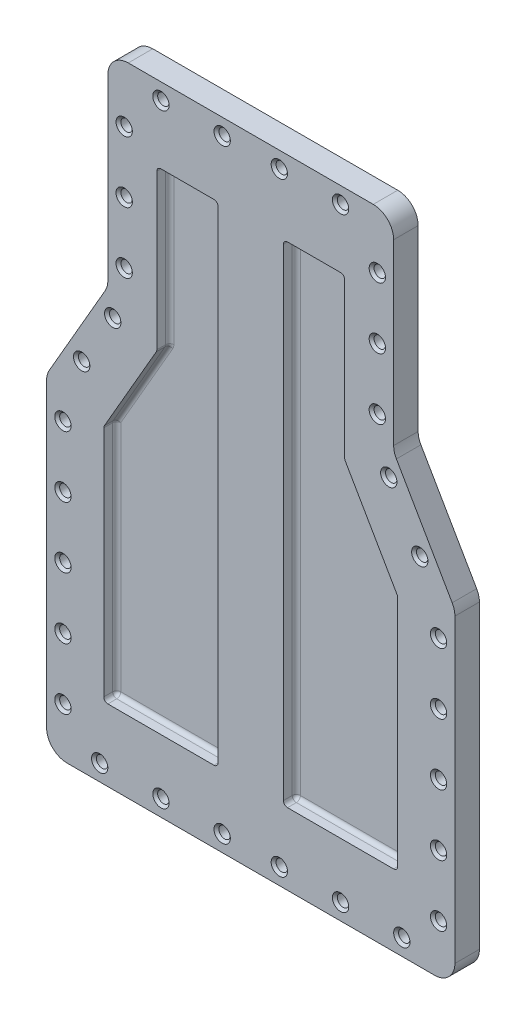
SolidWorks part; units mm, degrees
ref_plane "Front Plane" through (0, 0, 0) normal (0, 0, 1) x (1, 0, 0)
ref_plane "Top Plane" through (0, 0, 0) normal (0, 1, 0) x (1, 0, 0)
ref_plane "Right Plane" through (0, 0, 0) normal (1, 0, 0) x (0, 0, -1)
sketch "Sketch1" plane through (0, 0, 0) normal (0, 0, 1) x (1, 0, 0)
  line L0 (-175, 780) -> (-175, 530)
  line L1 (-250, 0) -> (250, 0)
  line L2 (-250, 0) -> (-250, 400)
  line L3 (-175, 780) -> (175, 780)
  line L4 (250, 0) -> (250, 400)
  line L5 (-175, 530) -> (-250, 400)
  line L7 (250, 400) -> (175, 530)
  line L8 (175, 530) -> (175, 780)
  dimension "D1" = 250
  dimension "D2" = 500
  dimension "D3" = 780
  dimension "D4" = 175
  dimension "D5" = 350
  dimension "D6" = 250
  dimension "D7" = 400
extrude "Boss-Extrude1" add sketch "Sketch1" along normal blind 30
hole_wizard "CSK for M2 Flat Head Machine Screw2" positions "Sketch5" profile "Sketch4" countersink size "M2" standard "ANSI Metric"
sketch "Sketch5" plane through (0, 0, 30) normal (0, 0, 1) x (1, 0, 0)
  line L0 (-294.6274, 20) -> (370.1384, 20) construction
  line L2 (230, -64.9529) -> (230, 537.3409) construction
  line L4 (155, 460.4524) -> (155, 825.6731) construction
  line L6 (230.7778, 760) -> (-219.3407, 760) construction
  line L7 (0, -204.3134) -> (0, 940.3652) construction
  line L9 (-155, 460.4524) -> (-155, 825.6731) construction
  point P18 (35, 20)
  point P20 (110, 20)
  point P22 (185, 20)
  point P24 (230, 60)
  point P26 (230, 135)
  point P28 (230, 210)
  point P30 (230, 285)
  point P32 (230, 360)
  point P34 (155, 560)
  point P36 (155, 635)
  point P38 (155, 710)
  point P40 (110, 760)
  point P42 (35, 760)
  point P44 (207, 435)
  point P46 (169, 500)
  point P54 (-169, 500)
  point P55 (-207, 435)
  point P56 (-35, 760)
  point P57 (-110, 760)
  point P58 (-155, 710)
  point P59 (-155, 635)
  point P60 (-155, 560)
  point P61 (-230, 360)
  point P62 (-230, 285)
  point P63 (-230, 210)
  point P64 (-230, 135)
  point P65 (-230, 60)
  point P66 (-185, 20)
  point P67 (-110, 20)
  point P68 (-35, 20)
  dimension "D1" = 20
  dimension "D2" = 230
  dimension "D3" = 155
  dimension "D4" = 740
  dimension "D5" = 35
  dimension "D6" = 110
  dimension "D7" = 185
  dimension "D8" = 40
  dimension "D9" = 115
  dimension "D10" = 190
  dimension "D11" = 265
  dimension "D12" = 340
  dimension "D13" = 415
  dimension "D14" = 480
  dimension "D15" = 690
  dimension "D16" = 615
  dimension "D17" = 540
  dimension "D18" = 207
  dimension "D19" = 169
  dimension "D20" = 35
  dimension "D21" = 110
sketch "Sketch4" plane through (35, 20, 30) normal (1, 0, 0) x (0, -1, 0)
  line L0 (0, 0) -> (0, 30)
  line L1 (0, 30) -> (7, 30)
  line L2 (7, 30) -> (7, 3)
  line L3 (7, 3) -> (10, 0)
  line L5 (10, 0) -> (0, 0)
  line L6 (-7, 3) -> (-10, 0) construction
  line L11 (0, -6.35) -> (0, 107.95) construction
  dimension "Thru Hole Dia." = 14
  dimension "Thru Hole Depth" = 30
  dimension "Near C'Sink Dia." = 20
  dimension "Near C'Sink Angle" = 90
sketch "Sketch6" plane through (0, 0, 30) normal (0, 0, 1) x (1, 0, 0)
  line L0 (180, 379.3205) -> (115, 491.9872)
  line L1 (40, 687.702) -> (115, 687.702)
  line L2 (40, 687.702) -> (40, 87.702)
  line L3 (40, 87.702) -> (180, 87.702)
  line L4 (115, 687.702) -> (115, 491.9872)
  line L6 (180, 87.702) -> (180, 379.3205)
  line L7 (250, 400) -> (175, 530) construction
  line L8 (0, -69.7691) -> (0, 810.0196) construction
  line L9 (-180, 87.702) -> (-180, 379.3205)
  line L10 (-115, 687.702) -> (-115, 491.9872)
  line L11 (-40, 87.702) -> (-180, 87.702)
  line L12 (-40, 687.702) -> (-40, 87.702)
  line L13 (-40, 687.702) -> (-115, 687.702)
  line L14 (-180, 379.3205) -> (-115, 491.9872)
  dimension "D1" = 40
  dimension "D2" = 140
  dimension "D3" = 600
  dimension "D4" = 75
  dimension "D5" = 87.702
  dimension "D6" = 70.967
extrude "Cut-Extrude1" cut sketch "Sketch6" against normal blind 15.811
sketch "Sketch7" plane through (0, 0, 0) normal (0, 0, -1) x (-1, 0, 0)
  line L44 (120, 725) -> (-120, 725)
  line L45 (120, 515.2722) -> (120, 725)
  line L46 (195, 385.2722) -> (120, 515.2722)
  line L47 (195, 55) -> (195, 385.2722)
  line L48 (-195, 55) -> (195, 55)
  line L49 (-195, 385.2722) -> (-195, 55)
  line L50 (-120, 515.2722) -> (-195, 385.2722)
  line L51 (-120, 725) -> (-120, 515.2722)
  line L52 (120, 725) -> (-120, 725)
  line L53 (120, 515.2722) -> (120, 725)
  line L54 (195, 385.2722) -> (120, 515.2722)
  line L55 (195, 55) -> (195, 385.2722)
  line L56 (-195, 55) -> (195, 55)
  line L57 (-195, 385.2722) -> (-195, 55)
  line L58 (-120, 515.2722) -> (-195, 385.2722)
  line L59 (-120, 725) -> (-120, 515.2722)
  dimension "D1" = 55
extrude "Boss-Extrude2" add sketch "Sketch7" along normal blind 40
sketch "Sketch8" plane through (0, 0, -40) normal (0, 0, -1) x (-1, 0, 0)
  line L0 (-195, 55) -> (195, 55) construction
  line L1 (-40, 655) -> (40, 655)
  line L2 (-40, 655) -> (-40, 505)
  line L3 (-40, 505) -> (40, 505)
  line L4 (40, 655) -> (40, 505)
  line L5 (-40, 455) -> (40, 455)
  line L6 (-40, 455) -> (-40, 305)
  line L7 (-40, 305) -> (40, 305)
  line L8 (40, 455) -> (40, 305)
  dimension "D1" = 150
  dimension "D2" = 150
  dimension "D3" = 50
  dimension "D4" = 250
  dimension "D5" = 40
  dimension "D6" = 80
extrude "Boss-Extrude3" add sketch "Sketch8" along normal blind 50
sketch "Sketch9" plane through (0, 305, 0) normal (0, -1, 0) x (1, 0, 0)
  line L0 (40, -90) -> (-40, -90) construction
  line L2 (-12.5, -65) -> (-12.5, -100.0631)
  line L3 (-12.5, -100.0631) -> (12.5, -100.0631)
  line L4 (12.5, -65) -> (12.5, -100.0631)
  arc A0 (-12.5, -65) -> (12.5, -65) centre (0, -65) cw
  dimension "D2" = 12.5
  dimension "D1" = 25
  dimension "D3" = 25
  dimension "D4" = 0
extrude "Cut-Extrude2" cut sketch "Sketch9" against normal through all
sketch "Sketch10" plane through (0, 0, -40) normal (0, 0, -1) x (-1, 0, 0)
  line L0 (-195, 55) -> (195, 55) construction
  line L2 (-25, 205) -> (-25, -37.0393)
  line L3 (-25, -37.0393) -> (25, -37.0393)
  line L4 (25, 205) -> (25, -37.0393)
  arc A0 (-25, 205) -> (25, 205) centre (0, 205) cw
  dimension "D3" = 150
  dimension "D1" = 50
  dimension "D2" = 25
extrude "Cut-Extrude3" cut sketch "Sketch10" against normal blind 25.125
sketch "Sketch11" plane through (0, 0, -40) normal (0, 0, -1) x (-1, 0, 0)
  line L0 (79, 338) -> (101, 403)
  line L1 (79, 273) -> (154, 273)
  line L2 (79, 273) -> (79, 338)
  line L3 (40, 305) -> (40, 455) construction
  line L4 (154, 273) -> (154, 338)
  line L5 (132, 403) -> (101, 403)
  line L6 (132, 403) -> (154, 338)
  line L7 (-195, 55) -> (195, 55) construction
  line L8 (0, -43.3508) -> (0, 492.2255) construction
  line L9 (-132, 403) -> (-154, 338)
  line L10 (-132, 403) -> (-101, 403)
  line L11 (-154, 273) -> (-154, 338)
  line L12 (-79, 273) -> (-79, 338)
  line L13 (-79, 273) -> (-154, 273)
  line L14 (-79, 338) -> (-101, 403)
  dimension "D1" = 31
  dimension "D2" = 75
  dimension "D3" = 22
  dimension "D4" = 65
  dimension "D5" = 130
  dimension "D6" = 39
  dimension "D7" = 218
extrude "Cut-Extrude4" cut sketch "Sketch11" against normal blind 26.25
sketch "Sketch12" plane through (0, 0, -40) normal (0, 0, -1) x (-1, 0, 0)
  line L0 (0, -48.461) -> (0, 270.1738) construction
  line L1 (65, 225) -> (125, 225)
  line L2 (65, 225) -> (65, 105)
  line L3 (-125, 225) -> (-125, 105)
  line L4 (125, 225) -> (125, 105)
  line L5 (-65, 225) -> (-65, 105)
  line L6 (-65, 225) -> (-125, 225)
  arc A0 (65, 105) -> (125, 105) centre (95, 105) ccw
  arc A1 (-65, 105) -> (-125, 105) centre (-95, 105) cw
  dimension "D1" = 60
  dimension "D2" = 65
  dimension "D3" = 225
  dimension "D4" = 120
extrude "Boss-Extrude4" add sketch "Sketch12" along normal blind 65
sketch "Sketch14" plane through (-125, 0, 0) normal (-1, 0, 0) x (0, 0, 1)
  line L0 (-40, 225) -> (-121.3524, 23.6457)
  line L2 (-121.3524, 225) -> (-121.3524, 23.6457)
  line L4 (-105, 225) -> (-40, 225) construction
  line L5 (-121.3524, 225) -> (-40, 225)
  dimension "D1" = 68
extrude "Cut-Extrude5" cut sketch "Sketch14" against normal through all
hole_wizard "M8x1.25 Tapped Hole1" positions "Sketch16" profile "Sketch15" tap size "M8x1.25" standard "ANSI Metric"
sketch "Sketch16" plane through (0, 0, -90) normal (0, 0, -1) x (-1, 0, 0)
  line L4 (77.4356, 625) -> (-79.1358, 625) construction
  line L6 (-79.1358, 580) -> (77.4356, 580) construction
  line L8 (77.4356, 535) -> (-79.1358, 535) construction
  line L18 (40, 655) -> (12.5, 655) construction
  point P39 (26.25, 625)
  point P41 (26.25, 580)
  point P43 (26.25, 535)
  point P57 (-26.25, 535)
  point P59 (-26.25, 580)
  point P61 (-26.25, 625)
  dimension "D3" = 30
  dimension "D4" = 45
  dimension "D5" = 45
sketch "Sketch15" plane through (-26.25, 625, -90) normal (1, 0, 0) x (0, 1, 0)
  line L0 (0, 0) -> (0, 26.9979)
  line L1 (0, 26.9979) -> (3.325, 25)
  line L2 (3.325, 25) -> (3.325, 0)
  line L5 (3.325, 0) -> (0, 0)
  line L10 (0, 26.9979) -> (-3.325, 25) construction
  line L11 (0, -6.35) -> (0, 107.95) construction
  dimension "Tap Drill Dia." = 6.65
  dimension "Tap Drill Depth" = 25
  dimension "Drill Angle" = 118
hole_wizard "Ø0.15 (0.15) Diameter Hole3" positions "Sketch18" profile "Sketch17" hole size "Ø0.15" standard "ANSI Metric"
sketch "Sketch18" plane through (0, 0, -90) normal (0, 0, -1) x (-1, 0, 0)
  line L0 (-26.25, 465.5683) -> (-26.25, 272.6912) construction
  line L2 (26.25, 272.6912) -> (26.25, 465.5683) construction
  line L4 (61.9453, 425) -> (-55.7173, 425) construction
  line L6 (-55.7173, 380) -> (61.9453, 380) construction
  line L8 (61.9453, 335) -> (-55.7173, 335) construction
  line L10 (40, 305) -> (40, 455) construction
  line L11 (40, 455) -> (12.5, 455) construction
  point P25 (26.25, 335)
  point P27 (26.25, 380)
  point P29 (26.25, 425)
  point P31 (-26.25, 425)
  point P33 (-26.25, 380)
  point P35 (-26.25, 335)
  dimension "D1" = 13.75
  dimension "D2" = 52.5
  dimension "D3" = 45
  dimension "D4" = 45
  dimension "D5" = 30
sketch "Sketch17" plane through (-26.25, 335, -90) normal (1, 0, 0) x (0, 1, 0)
  line L0 (0, 0) -> (0, 26.9979)
  line L1 (0, 26.9979) -> (3.325, 25)
  line L2 (3.325, 25) -> (3.325, 0)
  line L5 (3.325, 0) -> (0, 0)
  line L10 (0, 26.9979) -> (-3.325, 25) construction
  line L11 (0, -6.35) -> (0, 107.95) construction
  dimension "Hole Dia." = 6.65
  dimension "Hole Depth" = 25
  dimension "Drill Angle" = 118
hole_wizard "Ø0.15 (0.15) Diameter Hole1" positions "Sketch20" profile "Sketch19" hole size "Ø0.15" standard "ANSI Metric"
sketch "Sketch20" plane through (0, 0, 0) normal (0, 0, -1) x (-1, 0, 0)
  point P0 (148.588, 752.095)
  point P2 (-223.588, 25)
  dimension "D1" = 223.588
  dimension "D2" = 25
  dimension "D3" = 148.588
  dimension "D4" = 752.095
sketch "Sketch19" plane through (-148.588, 752.095, 0) normal (1, 0, 0) x (0, 1, 0)
  line L0 (0, 0) -> (0, 18.6352)
  line L1 (0, 18.6352) -> (6.05, 15)
  line L2 (6.05, 15) -> (6.05, 0)
  line L5 (6.05, 0) -> (0, 0)
  line L10 (0, 18.6352) -> (-6.05, 15) construction
  line L11 (0, -6.35) -> (0, 107.95) construction
  dimension "Hole Dia." = 12.1
  dimension "Hole Depth" = 15
  dimension "Drill Angle" = 118
hole_wizard "Ø0.15 (0.15) Diameter Hole2" positions "Sketch22" profile "Sketch21" hole size "Ø0.15" standard "ANSI Metric"
sketch "Sketch22" plane through (-40, 0, 0) normal (-1, 0, 0) x (0, 0, 1)
  line L0 (-90, 655) -> (-40, 655) construction
  line L2 (-90, 505) -> (-90, 655) construction
  line L3 (-90, 305) -> (-90, 455) construction
  point P0 (-78, 602.5)
  point P2 (-78, 402.5)
  dimension "D1" = 52.5
  dimension "D2" = 12
  dimension "D3" = 12
  dimension "D4" = 200
sketch "Sketch21" plane through (-40, 602.5, -78) normal (0, 1, 0) x (0, 0, 1)
  line L0 (0, 0) -> (0, 290)
  line L1 (0, 290) -> (5, 290)
  line L2 (5, 290) -> (5, 0)
  line L5 (5, 0) -> (0, 0)
  line L11 (0, -6.35) -> (0, 107.95) construction
  dimension "Thru Hole Dia." = 10
  dimension "Thru Hole Depth" = 290
hole_wizard "M12x1.75 Tapped Hole1" positions "Sketch24" profile "Sketch23" tap size "M12x1.75" standard "ANSI Metric"
sketch "Sketch24" plane through (0, 45.4674, -112.5359) normal (0, 0.3746, -0.9272) x (-1, 0, 0)
  line L0 (125, 64.2079) -> (125, 193.6321) construction
  point P0 (95, 64.2079)
  point P2 (95, 159.2079)
  point P4 (-95, 159.2079)
  point P6 (-95, 64.2079)
  dimension "D1" = 30
  dimension "D2" = 30
  dimension "D3" = 0
  dimension "D4" = 95
  dimension "D5" = 95
  dimension "D6" = 0
  dimension "D7" = 190
  dimension "D8" = 190
sketch "Sketch23" plane through (-95, 105, -88.4831) normal (1, 0, 0) x (0, 0.9272, 0.3746)
  line L0 (0, 0) -> (0, 33.0644)
  line L1 (0, 33.0644) -> (5.1, 30)
  line L2 (5.1, 30) -> (5.1, 0)
  line L5 (5.1, 0) -> (0, 0)
  line L10 (0, 33.0644) -> (-5.1, 30) construction
  line L11 (0, -6.35) -> (0, 107.95) construction
  dimension "Tap Drill Dia." = 10.2
  dimension "Tap Drill Depth" = 30
  dimension "Drill Angle" = 118
hole_wizard "CBORE for M5 Hex Head Bolt1" positions "Sketch26" profile "Sketch25" counterbore size "M5" standard "ANSI Metric"
sketch "Sketch26" plane through (0, 45.4674, -112.5359) normal (0, 0.3746, -0.9272) x (-1, 0, 0)
  line L0 (125, 64.2079) -> (125, 193.6321) construction
  point P0 (95, 94.2079)
  point P2 (95, 129.2079)
  point P4 (-95, 129.2079)
  point P6 (-95, 94.2079)
  dimension "D1" = 30
  dimension "D2" = 30
  dimension "D3" = 190
  dimension "D4" = 190
  dimension "D5" = 35
  dimension "D6" = 35
  dimension "D7" = 30
  dimension "D8" = 30
sketch "Sketch25" plane through (-95, 132.8155, -77.2449) normal (1, 0, 0) x (0, 0.9272, 0.3746)
  line L0 (0, 0) -> (0, 43.6052)
  line L1 (0, 43.6052) -> (6, 40)
  line L2 (6, 40) -> (6, 20)
  line L3 (6, 20) -> (10, 20)
  line L4 (10, 20) -> (10, 0)
  line L5 (10, 0) -> (0, 0)
  line L10 (0, 43.6052) -> (-6, 40) construction
  line L11 (0, -6.35) -> (0, 107.95) construction
  dimension "Hole Dia." = 12
  dimension "Hole Depth" = 40
  dimension "C'Bore Dia." = 20
  dimension "C'Bore Depth" = 20
  dimension "Drill Angle" = 118
fillet "Fillet1" radius 25 8 edges at (-250, 0, 15) (-250, 400, 15) (-175, 530, 15) (-175, 780, 15) (250, 0, 15) (250, 400, 15) (175, 530, 15) (175, 780, 15)
fillet "Fillet2" radius 13 8 edges at (-120, 725, -20) (-120, 515.2722, -20) (-195, 385.2722, -20) (-195, 55, -20) (195, 55, -20) (195, 385.2722, -20) (120, 515.2722, -20) (120, 725, -20)
fillet "Fillet3" radius 5 33 edges at (116.1924, 721.1924, 0) (0, 725, 0) (-116.1924, 721.1924, 0) (-120, 615.3767, 0) (-120.4424, 515.3907, 0) (-157.5, 450.2722, 0) (-194.5576, 385.1538, 0) (-195, 224.8956, 0) (-191.1924, 58.8076, 0) (0, 55, 0) (191.1924, 58.8076, 0) (195, 224.8956, 0) (194.5576, 385.1538, 0) (157.5, 450.2722, 0) (120.4424, 515.3907, 0) (-103.5, 55, -40) (-191.1924, 58.8076, -40) (-195, 224.8956, -40) (-194.5576, 385.1538, -40) (-157.5, 450.2722, -40) (-120.4424, 515.3907, -40) (-120, 615.3767, -40) (-116.1924, 721.1924, -40) (0, 725, -40) (116.1924, 721.1924, -40) (120, 615.3767, -40) (120.4424, 515.3907, -40) (103.5, 55, -40) (191.1924, 58.8076, -40) (195, 224.8956, -40) (194.5576, 385.1538, -40) (120, 615.3767, 0) (157.5, 450.2722, -40)
fillet "Fillet4" radius 2.5 3 edges at (25, 130, -14.875) (0, 230, -14.875) (-25, 130, -14.875)
fillet "Fillet5" radius 4 16 edges at (40, 305, -65) (-40, 305, -65) (-40, 455, -65) (40, 455, -65) (40, 505, -65) (-40, 505, -65) (-40, 655, -65) (40, 655, -65) (40, 380, -40) (0, 305, -40) (-40, 380, -40) (0, 455, -40) (0, 505, -40) (-40, 580, -40) (0, 655, -40) (40, 580, -40)
fillet "Fillet6" radius 5 54 edges at (-180, 233.5113, 14.189) (-147.5, 435.6538, 14.189) (-115, 589.8446, 14.189) (-77.5, 687.702, 14.189) (-40, 387.702, 14.189) (-110, 87.702, 14.189) (77.5, 687.702, 14.189) (115, 589.8446, 14.189) (147.5, 435.6538, 14.189) (180, 233.5113, 14.189) (110, 87.702, 14.189) (40, 387.702, 14.189) (-40, 87.702, 22.0945) (-40, 687.702, 22.0945) (-115, 687.702, 22.0945) (-115, 491.9872, 22.0945) (-180, 379.3205, 22.0945) (-180, 87.702, 22.0945) (40, 87.702, 22.0945) (40, 687.702, 22.0945) (115, 687.702, 22.0945) (115, 491.9872, 22.0945) (180, 379.3205, 22.0945) (180, 87.702, 22.0945) (125, 165, -40) (95, 75, -40) (-65, 165, -40) (-95, 75, -40) (90, 370.5, -13.75) (79, 305.5, -13.75) (116.5, 273, -13.75) (154, 305.5, -13.75) (143, 370.5, -13.75) (116.5, 403, -13.75) (-90, 370.5, -13.75) (-116.5, 403, -13.75) (-143, 370.5, -13.75) (-154, 305.5, -13.75) (-116.5, 273, -13.75) (-79, 305.5, -13.75) (-79, 338, -26.875) (-79, 273, -26.875) (-154, 273, -26.875) (-154, 338, -26.875) (-132, 403, -26.875) (-101, 403, -26.875) (132, 403, -26.875) (101, 403, -26.875) (79, 338, -26.875) (79, 273, -26.875) (154, 338, -26.875) (154, 273, -26.875) (65, 165, -40) (-125, 165, -40)
chamfer "Chamfer1" distance 5 angle 45 24 edges at (89.5571, 369.1914, -40) (101.6721, 402.0629, -40) (116.5, 403, -40) (131.3279, 402.0629, -40) (143.4429, 369.1914, -40) (153.9336, 337.9891, -40) (154, 307.5884, -40) (152.5355, 274.4645, -40) (116.5, 273, -40) (80.4645, 274.4645, -40) (79, 307.5884, -40) (79.0664, 337.9891, -40) (-153.9336, 337.9891, -40) (-143.4429, 369.1914, -40) (-131.3279, 402.0629, -40) (-116.5, 403, -40) (-101.6721, 402.0629, -40) (-89.5571, 369.1914, -40) (-79.0664, 337.9891, -40) (-79, 307.5884, -40) (-80.4645, 274.4645, -40) (-116.5, 273, -40) (-152.5355, 274.4645, -40) (-154, 307.5884, -40)
ref_point "Point1"
sketch "Sketch27" plane through (0, 0, -13.75) normal (0, 0, -1) x (-1, 0, 0)
  line L0 (0, 71.8322) -> (0, -71.8322) construction
  line L1 (71.8322, 0) -> (-71.8322, 0) construction
  circle A0 centre (-115, 330) radius 17.5
  dimension "D2" = 35
  dimension "D1" = 115
  dimension "D3" = 330
ref_plane "Plane1" through (0, 179.5326, 72.5359) normal (0, 0.9272, 0.3746) x (-1, 0, 0)
ref_plane "Plane15" through (-125, 105, -88.4831) normal (0, 0.9272, 0.3746) x (1, 0, 0)
sketch "Sketch29" plane through (0, 0, -40) normal (0, 0, -1) x (-1, 0, 0)
  line L0 (-36, 305) -> (36, 305) construction
  line L1 (-40, 451) -> (-40, 309) construction
  line L2 (-40, 305) -> (36, 305)
  line L3 (-40, 451) -> (-40, 305)
  line L4 (-36, 505) -> (36, 505) construction
  line L5 (-40, 651) -> (-40, 509) construction
  line L6 (-40, 505) -> (36, 505)
  line L7 (-40, 651) -> (-40, 505)
sketch "Sketch30" plane through (0, 0, 0) normal (0, -1, 0) x (1, 0, 0)
  line L0 (158.2189, 7.5) -> (158.2189, 18.3043)
  line L1 (154.0232, 22.5) -> (138.8227, 22.5)
  line L2 (138.8227, 13.4771) -> (148.4494, 13.4771)
  line L3 (148.3345, 10.661) -> (132.6444, 10.661)
  line L4 (132.6444, 10.661) -> (132.6444, 22.5)
  line L5 (132.6444, 22.5) -> (129.5419, 22.5)
  line L6 (129.5419, 22.5) -> (129.5419, 10.661)
  line L7 (129.5419, 10.661) -> (123.1326, 10.661)
  line L8 (123.1326, 10.661) -> (123.1326, 7.5)
  line L9 (123.1326, 7.5) -> (148.7359, 7.5)
  line L10 (148.3919, 16.5804) -> (139.3401, 16.5804)
  line L11 (139.2826, 19.3968) -> (153.9941, 19.3968)
  line L12 (155.0866, 18.3043) -> (155.0866, 7.5)
  line L13 (155.0866, 7.5) -> (158.2189, 7.5)
  line L14 (180, 22.5) -> (180, 10.3379)
  line L15 (174.3448, 8.1239) -> (164.08, 19.2243)
  line L16 (163.3623, 18.9081) -> (163.3623, 7.5)
  line L17 (163.3623, 7.5) -> (160.2301, 7.5)
  line L18 (160.2301, 7.5) -> (160.2301, 18.9829)
  line L19 (166.4932, 21.1806) -> (175.9603, 10.891)
  line L20 (176.8975, 11.2565) -> (176.8975, 22.5)
  line L21 (176.8975, 22.5) -> (180, 22.5)
  arc A0 (158.2189, 18.3043) -> (154.0232, 22.5) centre (154.0232, 18.3043) ccw
  arc A1 (138.8227, 22.5) -> (138.8227, 13.4771) centre (139.5411, 17.9885) ccw
  arc A2 (148.3345, 10.661) -> (148.4494, 13.4771) centre (148.4494, 12.0667) ccw
  arc A3 (148.7359, 7.5) -> (148.3919, 16.5804) centre (148.7359, 12.0467) ccw
  arc A4 (139.2826, 19.3968) -> (139.3401, 16.5804) centre (139.4628, 17.9917) ccw
  arc A5 (174.3448, 8.1239) -> (180, 10.3379) centre (176.739, 10.3379) ccw
  arc A6 (164.08, 19.2243) -> (163.3623, 18.9081) centre (163.7755, 18.9428) ccw
  arc A7 (175.9603, 10.891) -> (176.8975, 11.2565) centre (176.3576, 11.2565) ccw
  arc A8 (155.0866, 18.3043) -> (153.9941, 19.3968) centre (153.9941, 18.3043) ccw
  arc A9 (166.4932, 21.1806) -> (160.2301, 18.9829) centre (163.7472, 18.9829) ccw
extrude "Cut-Extrude6" cut sketch "Sketch30" against normal blind 2
